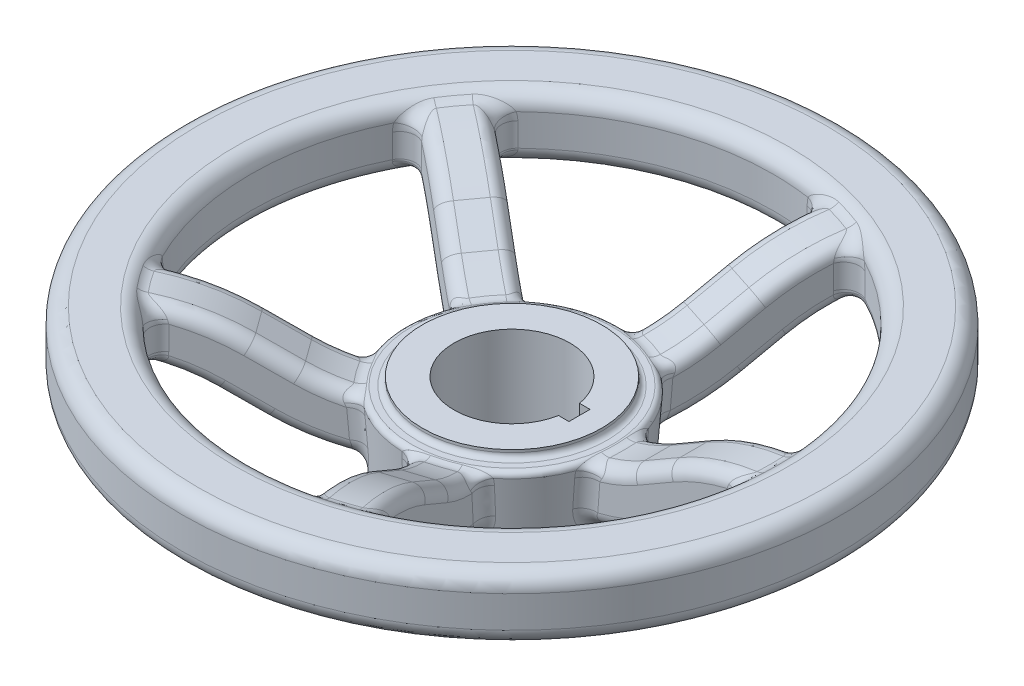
SolidWorks part; units mm, degrees
extrude "Base-Extrusion" add sketch "Esquisse2" along normal blind 18 draft 4
sketch "Esquisse2" plane through (0, 0, 0) normal (0, 1, 0) x (1, 0, 0)
  circle A0 centre (0, 0) radius 19
  dimension "D1" = 38
ref_plane "Face" through (0, 0, 0) normal (0, 0, 1) x (1, 0, 0)
ref_plane "Dessus" through (0, 0, 0) normal (0, 1, 0) x (1, 0, 0)
ref_plane "Profil" through (0, 0, 0) normal (1, 0, 0) x (0, 0, -1)
sketch "Esquisse3" plane through (0, 0, 0) normal (0, 0, 1) x (1, 0, 0)
  line L0 (0, 0) -> (0, 37.1194) construction
  line L1 (0, 18) -> (0, 0) construction
  line L2 (0, 11.7209) -> (12.6218, 11.7209)
  line L3 (30.1218, 16.4101) -> (36.8782, 20.3109)
  line L4 (54.3782, 25) -> (60, 25)
  arc A0 (30.1218, 16.4101) -> (12.6218, 11.7209) centre (12.6218, 46.7209) cw
  arc A1 (54.3782, 25) -> (36.8782, 20.3109) centre (54.3782, -10) ccw
  point P11 (22, 11.7209)
  point P14 (45, 25)
  dimension "D6" = 35
  dimension "D1" = 60
  dimension "D2" = 22
  dimension "D3" = 150
  dimension "D4" = 45
  dimension "D5" = 25
sketch "Esquisse4" plane through (0, 0, 0) normal (1, 0, 0) x (0, 0, -1)
  line L0 (0, 31.4599) -> (0, 7.8045) construction
  line L1 (0, 18) -> (0, 0) construction
  line L2 (-2.5, 16.7209) -> (2.5, 16.7209)
  line L3 (5, 14.2209) -> (5, 9.2209)
  line L4 (-5, 14.2209) -> (-5, 9.2209)
  line L5 (2.5, 6.7209) -> (-2.5, 6.7209)
  arc A0 (5, 14.2209) -> (2.5, 16.7209) centre (2.5, 14.2209) ccw
  arc A1 (2.5, 6.7209) -> (5, 9.2209) centre (2.5, 9.2209) ccw
  arc A2 (-5, 14.2209) -> (-2.5, 16.7209) centre (-2.5, 14.2209) cw
  arc A3 (-2.5, 6.7209) -> (-5, 9.2209) centre (-2.5, 9.2209) cw
  point P7 (0, 16.7209)
  point P10 (0, 6.7209)
  point P12 (5, 16.7209)
  point P15 (5, 6.7209)
  point P18 (-5, 16.7209)
  point P21 (-5, 6.7209)
  dimension "D1" = 2.5
  dimension "D2" = 5
  dimension "D3" = 10
  dimension "D4" = 5
sketch "Esquisse6" plane through (0, 18, 0) normal (0, 1, 0) x (-1, 0, 0)
  circle A0 centre (0, 0) radius 17
  circle A1 centre (0, 0) radius 20.2587 construction
  dimension "D1" = 34
extrude "Boss.-Extru.1" add sketch "Esquisse6" along normal blind 1.5
fillet "Congé6" radius 1
sweep "Bras" add profiles "Esquisse4" path "Esquisse3"
fillet "Congé2" radius 3
sketch "Esquisse5" plane through (0, 0, 0) normal (0, 0, 1) x (1, 0, 0)
  line L0 (0, 16.9302) -> (0, 0.9302) construction
  line L1 (52.5, 31) -> (59.5, 31)
  line L2 (49.5, 28) -> (49.5, 22)
  line L3 (52.5, 19) -> (59.5, 19)
  line L4 (62.5, 28) -> (62.5, 22)
  line L5 (0, -5.9754) -> (0, 15.6667) construction
  arc A0 (52.5, 31) -> (49.5, 28) centre (52.5, 28) ccw
  arc A1 (62.5, 28) -> (59.5, 31) centre (59.5, 28) ccw
  arc A2 (62.5, 22) -> (59.5, 19) centre (59.5, 22) cw
  arc A3 (49.5, 22) -> (52.5, 19) centre (52.5, 22) ccw
  dimension "D5" = 3
  dimension "D1" = 62.5
  dimension "D2" = 13
  dimension "D3" = 19
  dimension "D4" = 12
revolve "Boss.-Révol.1" add sketch "Esquisse5" angle 360 about L5
fillet "Congé3" radius 3
pattern_circular "Répétition circulaire3" count 5 over 360
sketch "Esquisse7" plane through (0, 19.5, 0) normal (0, 1, 0) x (-1, 0, 0)
  circle A0 centre (0, 0) radius 11
  dimension "D1" = 22
extrude "Alésage" cut sketch "Esquisse7" against normal through all
sketch "Esquisse8" plane through (0, 19.5, 0) normal (0, 1, 0) x (-1, 0, 0)
  line L0 (-14.6698, 0) -> (13.5913, 0) construction
  line L1 (-12.8, -2) -> (-12.8, 2)
  line L2 (-12.8, 2) -> (-8.2598, 2)
  line L3 (-12.8, -2) -> (-8.2598, -2)
  circle A0 centre (0, 0) radius 11 construction
  point P1 (11, 0)
  point P10 (-12.8, 0)
  dimension "D1" = 23.8
  dimension "D2" = 4
extrude "Rainure clavetage" cut sketch "Esquisse8" against normal through all and the other way through all
sketch "Esquisse10" plane through (0, 0, 0) normal (0, 1, 0) x (1, 0, 0)
  line L0 (0, 0) -> (73.9276, 0)
  line L1 (0, 0) -> (-59.8087, 43.4535)
  line L2 (-15.583, 14.4119) -> (-20.877, 18.2582) construction
  arc A0 (73.9276, 0) -> (-59.8087, 43.4535) centre (0, 0) ccw
extrude "Coupe" cut sketch "Esquisse10" along normal through all
